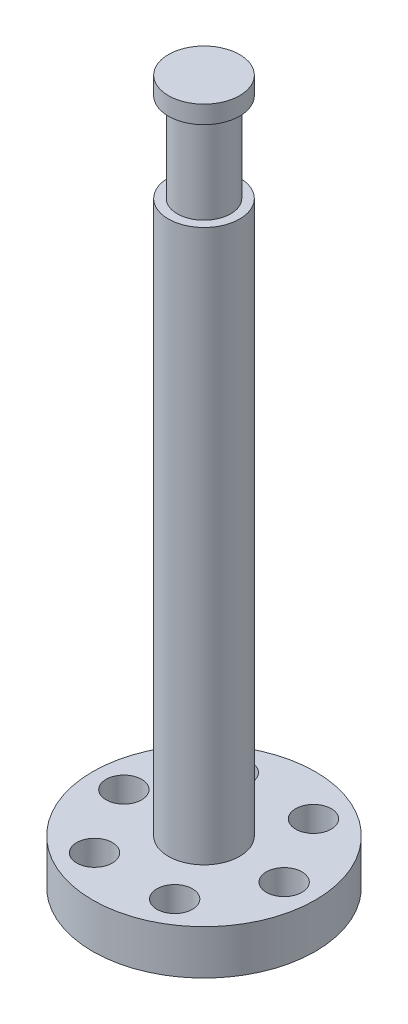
SolidWorks part; units mm, degrees
ref_plane "前视基准面" through (0, 0, 0) normal (0, 0, 1) x (1, 0, 0)
ref_plane "上视基准面" through (0, 0, 0) normal (0, 1, 0) x (1, 0, 0)
ref_plane "右视基准面" through (0, 0, 0) normal (1, 0, 0) x (0, 0, -1)
other "Configuration Table"
sketch "草图1" plane through (0, 0, 0) normal (0, 1, 0) x (1, 0, 0)
  circle A0 centre (0, 0) radius 12.5
  dimension "D1" = 25
extrude "凸台-拉伸1" add sketch "草图1" along normal blind 79
ref_plane "基准面1" through (0, 77, 0) normal (0, 1, 0) x (1, 0, 0)
sketch "草图2" plane through (0, 77, 0) normal (0, 1, 0) x (1, 0, 0)
  circle A0 centre (0, 0) radius 4
  dimension "D1" = 8
extrude "切除-拉伸2" cut sketch "草图2" against normal blind 72 flip side to cut
sketch "草图4" plane through (0, 77, 0) normal (0, 1, 0) x (1, 0, 0)
  circle A0 centre (0, 0) radius 4
  dimension "D1" = 8
extrude "切除-拉伸3" cut sketch "草图4" along normal through all flip side to cut
sketch "草图6" plane through (0, 77, 0) normal (0, 1, 0) x (1, 0, 0)
  circle A0 centre (0, 0) radius 3
  dimension "D1" = 6
extrude "切除-拉伸4" cut sketch "草图6" against normal blind 10 flip side to cut
sketch "草图7" plane through (0, 0, 0) normal (0, -1, 0) x (1, 0, 0)
  circle A0 centre (0, 0) radius 9 construction
  circle A1 centre (9, 0) radius 2
  dimension "D1" = 18
  dimension "D2" = 4
extrude "切除-拉伸5" cut sketch "草图7" against normal through all
pattern_circular "阵列(圆周)1" count 6 every 60 about axis through (0, 0, 0) along (0, 1, 0) of "切除-拉伸5"
